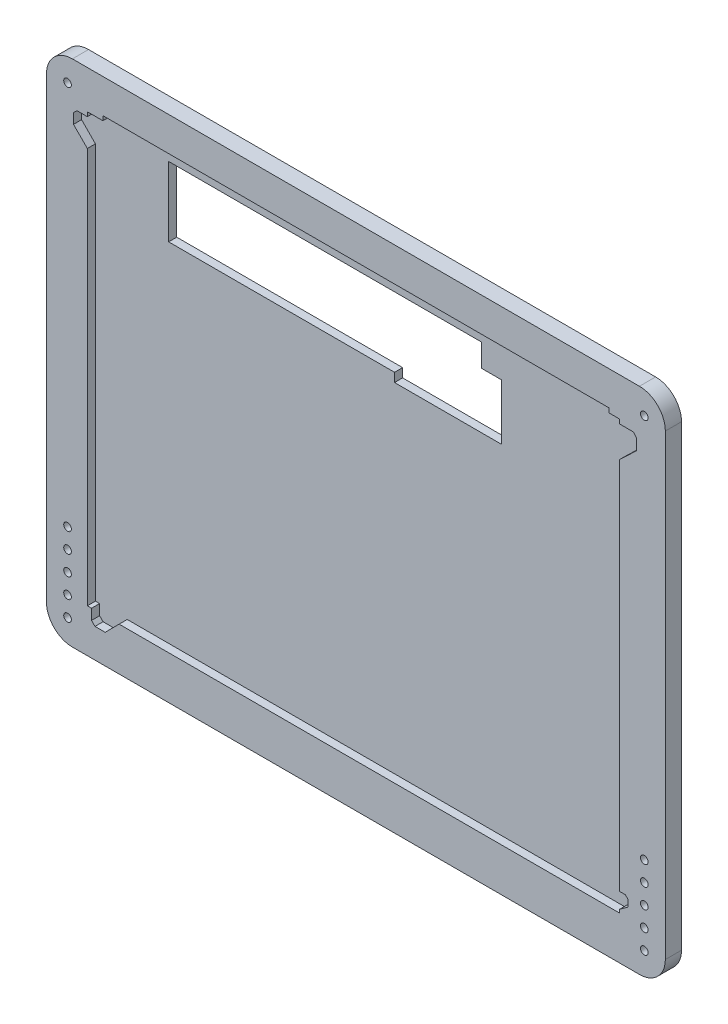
SolidWorks part; units mm, degrees
ref_plane "Front Plane" through (0, 0, 0) normal (0, 0, 1) x (1, 0, 0)
ref_plane "Top Plane" through (0, 0, 0) normal (0, 1, 0) x (1, 0, 0)
ref_plane "Right Plane" through (0, 0, 0) normal (1, 0, 0) x (0, 0, -1)
sketch "Sketch1" plane through (0, 0, 0) normal (0, 0, 1) x (1, 0, 0)
  line L6 (285.9719, 190.015) -> (508.635, 190.015)
  line L7 (275.8119, 179.855) -> (275.8119, 0.1472)
  line L8 (285.9719, -10.0128) -> (508.635, -10.0128)
  line L9 (518.795, 179.855) -> (518.795, 0.1472)
  line L10 (275.8119, 190.015) -> (518.795, -10.0128) construction
  line L11 (275.8119, -10.0128) -> (518.795, 190.015) construction
  arc A0 (275.8119, 0.1472) -> (285.9719, -10.0128) centre (285.9719, 0.1472) ccw
  arc A1 (508.635, -10.0128) -> (518.795, 0.1472) centre (508.635, 0.1472) ccw
  arc A2 (508.635, 190.015) -> (518.795, 179.855) centre (508.635, 179.855) cw
  arc A3 (285.9719, 190.015) -> (275.8119, 179.855) centre (285.9719, 179.855) ccw
  point P0 (397.3034, 90.0011)
extrude "Boss-Extrude1" add sketch "Sketch1" along normal blind 6.35
sketch "Sketch3" plane through (0, 0, 6.35) normal (0, 0, 1) x (1, 0, 0)
  line L0 (507.3865, 167.4044) -> (507.3865, 167.9661)
  line L2 (518.843, -10.0474) -> (275.8599, 189.9805) construction
  line L3 (518.843, 189.9805) -> (275.8599, -10.0474) construction
  line L4 (291.85, 174.9664) -> (500.8514, 174.9664)
  line L5 (500.8514, 174.9664) -> (500.8514, 173.29)
  line L6 (500.8514, 6.9657) -> (304.325, 6.9657)
  line L7 (291.85, 6.9657) -> (291.85, 162.4708)
  line L8 (293.4853, 6.9657) -> (291.85, 6.9657)
  line L9 (500.8514, 161.2081) -> (500.8514, 14.3413)
  line L10 (500.8514, 8.274) -> (500.8514, 6.9657)
  line L11 (504.2379, 10.732) -> (500.8514, 8.274)
  line L12 (504.2379, 13.1901) -> (504.2379, 10.732)
  line L13 (503.1178, 14.3413) -> (504.2379, 13.1901)
  line L14 (500.8514, 14.3413) -> (503.1178, 14.3413)
  line L15 (293.4853, 2.8117) -> (293.4853, 6.9657)
  line L16 (294.8498, 1.4559) -> (293.4853, 2.8117)
  line L17 (298.8503, 1.4559) -> (294.8498, 1.4559)
  line L18 (304.325, 6.9657) -> (298.8503, 1.4559)
  line L19 (507.3865, 167.4044) -> (500.8514, 161.2081)
  line L20 (507.3865, 171.9666) -> (507.3865, 167.9661)
  line L21 (506.255, 173.29) -> (507.3865, 171.9666)
  line L22 (291.85, 173.29) -> (291.85, 174.9664)
  line L23 (500.8514, 173.29) -> (506.255, 173.29)
  line L24 (286.41, 167.9661) -> (291.85, 162.4708)
  line L25 (286.41, 171.9666) -> (286.41, 167.9661)
  line L26 (287.8521, 173.29) -> (286.41, 171.9666)
  line L27 (291.85, 173.29) -> (287.8521, 173.29)
  point P0 (397.3515, 89.9665)
extrude "Cut-Extrude1" cut sketch "Sketch3" against normal blind 3.175
sketch "Sketch4" plane through (0, 0, 6.35) normal (0, 0, 1) x (1, 0, 0)
  line L0 (397.3034, 190.015) -> (397.3034, -10.0128) construction
  line L1 (275.8119, 90.0011) -> (518.795, 90.0011) construction
  circle A0 centre (284.0709, 180.9201) radius 1.5
  circle A1 centre (510.536, 180.9201) radius 1.5
  circle A2 centre (510.536, -0.9179) radius 1.5
  circle A3 centre (284.0709, -0.9179) radius 1.5
  circle A4 centre (284.0709, 6.7925) radius 1.5
  circle A5 centre (284.0709, 14.5029) radius 1.5
  circle A6 centre (284.0709, 22.2134) radius 1.5
  circle A7 centre (284.0709, 29.9238) radius 1.5
  circle A8 centre (510.536, 29.9238) radius 1.5
  circle A9 centre (510.536, 22.2134) radius 1.5
  circle A10 centre (510.536, 14.5029) radius 1.5
  circle A11 centre (510.536, 6.7925) radius 1.5
extrude "Cut-Extrude2" cut sketch "Sketch4" against normal through all
sketch "Sketch6" plane through (0, 0, 0) normal (0, 0, -1) x (-1, 0, 0)
  line L0 (-275.8119, 151.555) -> (-320.5953, 151.555) construction
  line L1 (-443.5358, 161.9333) -> (-451.3536, 161.9333)
  line L3 (-320.5953, 161.9333) -> (-320.5953, 170.8636)
  line L4 (-320.5953, 170.8636) -> (-443.5358, 170.8636)
  line L5 (-443.5358, 161.9333) -> (-443.5358, 170.8636)
  line L9 (-402.0288, 161.9333) -> (-402.0288, 190.015) construction
  line L10 (-320.5953, 161.9333) -> (-320.5953, 143.5105)
  line L11 (-409.2916, 143.5105) -> (-320.5953, 143.5105)
  line L12 (-451.3536, 161.9333) -> (-451.3536, 140.0209)
  line L13 (-409.2916, 140.0209) -> (-451.3536, 140.0209)
  line L14 (-409.2916, 143.5105) -> (-409.2916, 140.0209)
  point P15 (-275.8119, 151.555)
extrude "Cut-Extrude3" cut sketch "Sketch6" against normal blind 6.604
sketch "Sketch8" plane through (0, 0, 6.35) normal (0, 0, 1) x (1, 0, 0)
  line L0 (397.3034, 190.015) -> (397.3034, 14.0017) construction
  line L1 (275.8119, 90.0011) -> (518.795, 90.0011) construction
  line L2 (297.9506, 176.6972) -> (496.6562, 176.6972)
  line L3 (297.9506, 176.6972) -> (297.9506, 173.2355)
  line L4 (297.9506, 173.2355) -> (496.6562, 173.2355)
  line L5 (496.6562, 176.6972) -> (496.6562, 173.2355)
  line L6 (297.9506, 176.6972) -> (496.6562, 173.2355) construction
  line L7 (297.9506, 173.2355) -> (496.6562, 176.6972) construction
  point P4 (397.3034, 174.9664)
extrude "Cut-Extrude4" cut sketch "Sketch8" against normal blind 3.175
